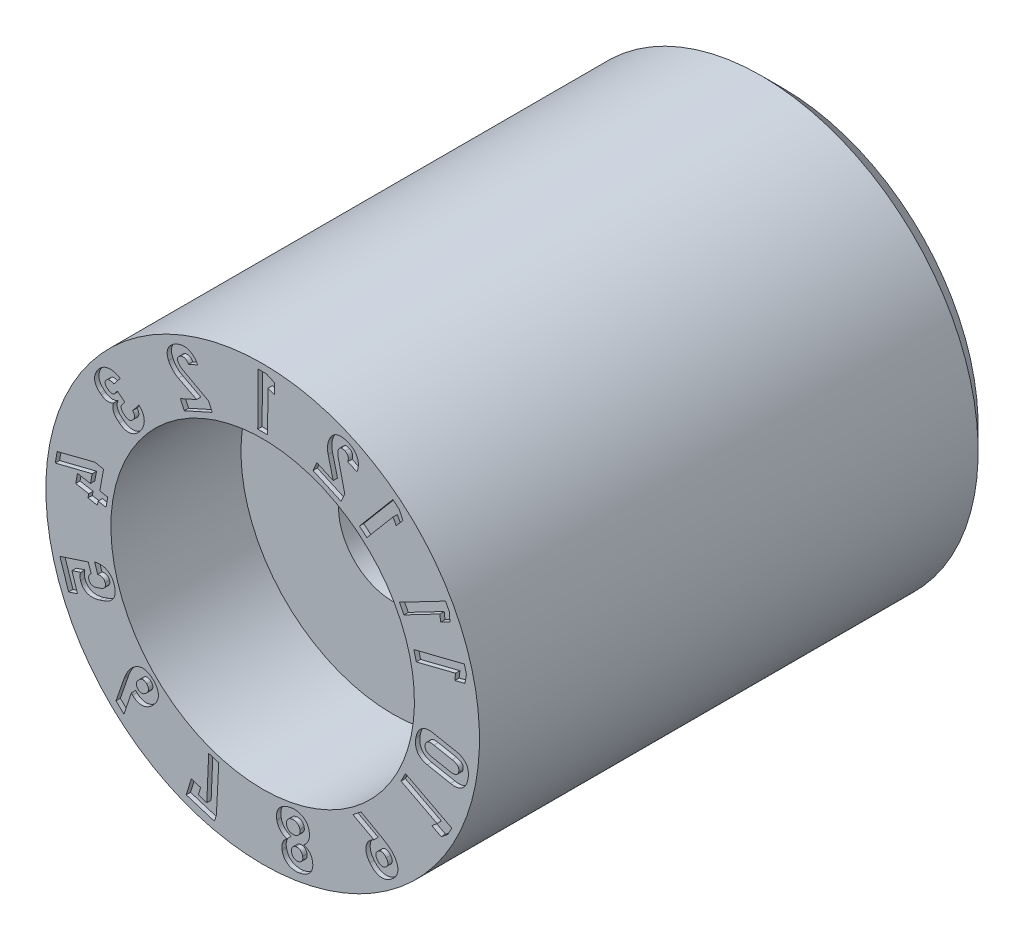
SolidWorks part; units mm, degrees
ref_plane "Front Plane" through (0, 0, 0) normal (0, 0, 1) x (1, 0, 0)
ref_plane "Top Plane" through (0, 0, 0) normal (0, 1, 0) x (1, 0, 0)
ref_plane "Right Plane" through (0, 0, 0) normal (1, 0, 0) x (0, 0, -1)
sketch "Sketch1" plane through (0, 0, 0) normal (1, 0, 0) x (0, 0, -1)
  line L0 (0, 0) -> (30.1243, 0) construction
  line L2 (12, 1.25) -> (12, 4.5)
  line L4 (11.5, 5) -> (0, 5)
  line L5 (0, 5) -> (0, 3.5)
  line L7 (0, 3.5) -> (3, 3.5)
  line L8 (3, 3.5) -> (3, 1.25)
  line L9 (3, 1.25) -> (12, 1.25)
  line L12 (12, 4.5) -> (11.5, 5)
  point P6 (12, 5)
  dimension "D1" = 12
  dimension "D2" = 10
  dimension "D3" = 7
  dimension "D4" = 3
  dimension "D5" = 2.5
revolve "Revolve1" add sketch "Sketch1" angle 360 about L0
sketch "Sketch2" plane through (0, 0, 0) normal (0, 0, 1) x (1, 0, 0)
  line L0 (-0.1135, 3.6352) -> (0.1131, 3.6331)
  line L1 (0.1131, 3.6331) -> (0.1221, 4.5702)
  line L2 (0.1221, 4.5702) -> (0.2681, 4.5131)
  line L3 (0.2681, 4.5131) -> (0.2706, 4.7542)
  line L4 (0.2706, 4.7542) -> (0.0915, 4.837)
  line L5 (0.0915, 4.837) -> (-0.102, 4.8387)
  line L6 (-0.102, 4.8387) -> (-0.1135, 3.6352)
  line L7 (-1.2464, 3.6295) -> (-1.8418, 3.9531)
  line L8 (-1.9547, 4.062) -> (-1.9554, 4.0631)
  line L9 (-1.7091, 4.1308) -> (-1.7088, 4.13)
  line L10 (-1.7088, 4.13) -> (-1.4979, 4.2247)
  line L11 (-1.4979, 4.2247) -> (-1.4982, 4.2256)
  line L12 (-2.1694, 3.9744) -> (-2.1692, 3.9735)
  line L13 (-1.9452, 3.738) -> (-1.5245, 3.5199)
  line L14 (-1.5245, 3.5199) -> (-1.8973, 3.3525)
  line L15 (-1.8973, 3.3525) -> (-1.8083, 3.1543)
  line L16 (-1.8083, 3.1543) -> (-1.1631, 3.4442)
  line L17 (-1.1631, 3.4442) -> (-1.2464, 3.6295)
  line L18 (-2.8539, 2.7446) -> (-2.998, 2.5616)
  line L19 (-3.1748, 2.37) -> (-3.1968, 2.3871)
  line L20 (-3.241, 2.5611) -> (-3.1784, 2.6408)
  line L21 (-3.1784, 2.6408) -> (-3.3492, 2.7753)
  line L22 (-3.3492, 2.7753) -> (-3.4118, 2.6956)
  line L23 (-3.5638, 2.7015) -> (-3.5802, 2.7143)
  line L24 (-3.4298, 2.8775) -> (-3.2861, 3.0602)
  line L25 (-3.7478, 2.5384) -> (-3.7195, 2.5162)
  line L26 (-3.3326, 2.1865) -> (-3.3043, 2.1642)
  line L27 (-3.8739, 1.096) -> (-4.7377, 0.8753)
  line L28 (-4.7377, 0.8753) -> (-4.7836, 0.6223)
  line L29 (-4.7836, 0.6223) -> (-3.9313, 0.8353)
  line L30 (-3.9313, 0.8353) -> (-3.9706, 0.6191)
  line L31 (-4.0281, 0.3027) -> (-3.8128, 0.2635)
  line L32 (-3.8128, 0.2635) -> (-3.7959, 0.3565)
  line L33 (-3.6685, 1.0588) -> (-3.8739, 1.096)
  line L34 (-4.2707, 0.6735) -> (-4.3112, 0.45)
  line L35 (-4.3112, 0.45) -> (-4.0112, 0.3956)
  line L36 (-3.6131, 0.3233) -> (-3.5726, 0.5469)
  line L37 (-3.5726, 0.5469) -> (-3.7554, 0.58)
  line L38 (-3.8745, -0.8977) -> (-3.8752, -0.898)
  line L39 (-3.8752, -0.898) -> (-3.8051, -1.1125)
  line L40 (-3.8051, -1.1125) -> (-3.8044, -1.1122)
  line L41 (-3.7341, -1.3553) -> (-3.8297, -1.3866)
  line L42 (-3.9556, -1.1739) -> (-4.0213, -0.9737)
  line L43 (-4.0213, -0.9737) -> (-4.6752, -1.1878)
  line L44 (-4.6752, -1.1878) -> (-4.475, -1.7986)
  line L45 (-4.475, -1.7986) -> (-4.2686, -1.731)
  line L46 (-4.2686, -1.731) -> (-4.3985, -1.3346)
  line L47 (-4.3985, -1.3346) -> (-4.1973, -1.2686)
  line L48 (-3.7595, -1.6007) -> (-3.664, -1.5694)
  line L49 (-3.0232, -2.5929) -> (-3.0237, -2.5932)
  line L50 (-3.1958, -2.8879) -> (-3.3813, -3.4249)
  line L51 (-3.3813, -3.4249) -> (-3.1992, -3.6027)
  line L52 (-3.1992, -3.6027) -> (-3.0268, -3.0886)
  line L54 (-2.5269, -3.0845) -> (-2.5265, -3.084)
  line L55 (-2.6777, -2.9168) -> (-2.6781, -2.9174)
  line L56 (-2.8555, -2.743) -> (-2.8548, -2.7424)
  line L57 (-1.0673, -4.554) -> (-1.0122, -3.4768)
  line L58 (-1.0122, -3.4768) -> (-1.245, -3.4044)
  line L59 (-1.245, -3.4044) -> (-1.288, -4.4148)
  line L60 (-1.288, -4.4148) -> (-1.4842, -4.3536)
  line L61 (-1.4842, -4.3536) -> (-1.4305, -4.1819)
  line L62 (-1.4305, -4.1819) -> (-1.6454, -4.115)
  line L63 (-1.6454, -4.115) -> (-1.7635, -4.4937)
  line L64 (-1.7635, -4.4937) -> (-1.1118, -4.6966)
  line L65 (-1.1118, -4.6966) -> (-1.0673, -4.554)
  line L66 (0.3252, -3.9393) -> (0.3287, -3.9588)
  line L67 (0.4457, -4.4703) -> (0.4513, -4.5013)
  line L68 (1.1505, -4.3755) -> (1.1449, -4.3445)
  line L69 (1.0763, -3.8242) -> (1.0728, -3.8048)
  line L70 (0.8567, -3.8773) -> (0.8587, -3.8888)
  line L71 (0.5551, -3.9426) -> (0.5528, -3.9304)
  line L72 (0.9211, -4.3757) -> (0.923, -4.387)
  line L73 (0.6684, -4.4321) -> (0.6663, -4.4198)
  line L75 (2.4713, -3.7322) -> (2.4717, -3.7328)
  line L76 (3.022, -3.298) -> (3.0214, -3.2971)
  line L77 (2.7548, -3.0924) -> (2.2697, -2.8197)
  line L78 (2.2697, -2.8197) -> (2.0814, -2.9668)
  line L79 (2.0814, -2.9668) -> (2.5645, -3.2277)
  line L80 (2.8498, -3.4447) -> (2.8504, -3.4456)
  line L81 (2.653, -3.5984) -> (2.6526, -3.5979)
  line L82 (3.2943, -1.542) -> (3.19, -1.7429)
  line L83 (3.19, -1.7429) -> (4.0203, -2.1744)
  line L84 (4.0203, -2.1744) -> (3.9037, -2.2785)
  line L85 (3.9037, -2.2785) -> (4.1173, -2.3895)
  line L86 (4.1173, -2.3895) -> (4.2717, -2.2676)
  line L87 (4.2717, -2.2676) -> (4.3609, -2.0961)
  line L88 (4.3609, -2.0961) -> (3.2943, -1.542)
  line L89 (3.7987, -1.1142) -> (4.3321, -1.2187)
  line L90 (4.4696, -0.5166) -> (3.9363, -0.4121)
  line L91 (3.9494, -0.6442) -> (4.3699, -0.7266)
  line L92 (4.3189, -0.9866) -> (3.8985, -0.9041)
  line L93 (3.4877, 1.0329) -> (3.5429, 0.8134)
  line L94 (3.5429, 0.8134) -> (4.449, 1.0412)
  line L95 (4.449, 1.0412) -> (4.4312, 0.8861)
  line L96 (4.4312, 0.8861) -> (4.664, 0.9446)
  line L97 (4.664, 0.9446) -> (4.699, 1.1381)
  line L98 (4.699, 1.1381) -> (4.6518, 1.3254)
  line L99 (4.6518, 1.3254) -> (3.4877, 1.0329)
  line L100 (3.1541, 1.8109) -> (3.2587, 1.6103)
  line L101 (3.2587, 1.6103) -> (4.0862, 2.042)
  line L102 (4.0862, 2.042) -> (4.1048, 1.8873)
  line L103 (4.1048, 1.8873) -> (4.3175, 1.9981)
  line L104 (4.3175, 1.9981) -> (4.3065, 2.1941)
  line L105 (4.3065, 2.1941) -> (4.2172, 2.3653)
  line L106 (4.2172, 2.3653) -> (3.1541, 1.8109)
  line L107 (2.2316, 2.872) -> (2.4041, 2.7264)
  line L108 (2.4041, 2.7264) -> (3.005, 3.4385)
  line L109 (3.005, 3.4385) -> (3.0807, 3.3026)
  line L110 (3.0807, 3.3026) -> (3.2351, 3.4855)
  line L111 (3.2351, 3.4855) -> (3.1508, 3.6624)
  line L112 (3.1508, 3.6624) -> (3.0036, 3.7867)
  line L113 (3.0036, 3.7867) -> (2.2316, 2.872)
  line L114 (1.8938, 3.3388) -> (1.7411, 4.0027)
  line L115 (1.7481, 4.1604) -> (1.7488, 4.1618)
  line L116 (1.9634, 4.0211) -> (1.9631, 4.0204)
  line L117 (1.9631, 4.0204) -> (2.1749, 3.9248)
  line L118 (2.1749, 3.9248) -> (2.1752, 3.9255)
  line L119 (1.539, 4.2637) -> (1.5386, 4.263)
  line L120 (1.5104, 3.9374) -> (1.6262, 3.4754)
  line L121 (1.6262, 3.4754) -> (1.2517, 3.6447)
  line L122 (1.2517, 3.6447) -> (1.1619, 3.4457)
  line L123 (1.1619, 3.4457) -> (1.8097, 3.1529)
  line L124 (1.8097, 3.1529) -> (1.8938, 3.3388)
  line L125 (-4.0112, 0.3956) -> (-4.0281, 0.3027)
  line L126 (-3.9706, 0.6191) -> (-4.2707, 0.6735)
  line L127 (-3.7959, 0.3565) -> (-3.6131, 0.3233)
  line L128 (-3.7554, 0.58) -> (-3.6685, 1.0588)
  circle A0 centre (0, 0) radius 3.645 construction
  spline S0 degree 3 poles (-1.8418, 3.9531) (-1.867, 3.9666) (-1.8968, 3.9868) (-1.9253, 4.0171) (-1.9409, 4.036) (-1.9498, 4.0515) (-1.9547, 4.062) knots 0 0 0 0 0.539913 0.664504 0.783194 1 1 1 1
  spline S1 degree 3 poles (-1.9554, 4.0631) (-1.9611, 4.0765) (-1.9676, 4.0975) (-1.9649, 4.1257) (-1.9582, 4.145) (-1.9469, 4.1629) (-1.9249, 4.1857) (-1.903, 4.1978) (-1.8875, 4.2049) knots 0 0 0 0 0.247437 0.358127 0.470367 0.587238 0.711484 1 1 1 1
  spline S2 degree 3 poles (-1.8875, 4.2049) (-1.8718, 4.2123) (-1.8468, 4.2187) (-1.813, 4.2165) (-1.7892, 4.2089) (-1.7663, 4.197) (-1.7371, 4.1724) (-1.7193, 4.1486) (-1.7091, 4.1308) knots 0 0 0 0 0.24188 0.354192 0.469267 0.588145 0.713727 1 1 1 1
  spline S3 degree 3 poles (-1.4982, 4.2256) (-1.515, 4.2564) (-1.5425, 4.3005) (-1.589, 4.3492) (-1.6253, 4.3796) (-1.6641, 4.4039) (-1.7048, 4.4224) (-1.7473, 4.4346) (-1.7914, 4.4407) (-1.8366, 4.4408) (-1.8992, 4.4322) (-1.945, 4.4167) (-1.9748, 4.4033) knots 0 0 0 0 0.185833 0.271834 0.354543 0.434819 0.51279 0.589574 0.667545 0.746873 0.827489 1 1 1 1
  spline S4 degree 3 poles (-1.9748, 4.4033) (-2.0064, 4.3891) (-2.0509, 4.3649) (-2.1024, 4.3246) (-2.1342, 4.2928) (-2.1604, 4.2589) (-2.1802, 4.2227) (-2.1942, 4.1847) (-2.2016, 4.1448) (-2.2032, 4.1035) (-2.1964, 4.0452) (-2.1818, 4.0024) (-2.1694, 3.9744) knots 0 0 0 0 0.194478 0.282548 0.366162 0.445731 0.521908 0.596846 0.672104 0.748713 0.827648 1 1 1 1
  spline S5 degree 3 poles (-2.1692, 3.9735) (-2.1577, 3.9489) (-2.1381, 3.9127) (-2.1049, 3.8689) (-2.0774, 3.8373) (-2.0473, 3.8082) (-2.0044, 3.7731) (-1.9697, 3.7505) (-1.9452, 3.738) knots 0 0 0 0 0.246354 0.371239 0.498231 0.625664 0.750716 1 1 1 1
  spline S6 degree 3 poles (-2.8278, 2.2359) (-2.8067, 2.2631) (-2.7785, 2.3056) (-2.7519, 2.3666) (-2.7382, 2.4118) (-2.7303, 2.4571) (-2.7295, 2.5021) (-2.7339, 2.5466) (-2.7452, 2.5901) (-2.7627, 2.6323) (-2.7953, 2.6873) (-2.8289, 2.723) (-2.8539, 2.7446) knots 0 0 0 0 0.181596 0.267032 0.34959 0.429882 0.508385 0.585788 0.66456 0.74419 0.825879 1 1 1 1
  spline S7 degree 3 poles (-2.998, 2.5616) (-2.9898, 2.5532) (-2.9788, 2.5398) (-2.9677, 2.5202) (-2.9613, 2.5057) (-2.9576, 2.4909) (-2.9555, 2.4762) (-2.9552, 2.4615) (-2.9571, 2.4468) (-2.961, 2.4324) (-2.9692, 2.413) (-2.9778, 2.3994) (-2.9845, 2.3908) knots 0 0 0 0 0.186026 0.272842 0.355692 0.435875 0.513332 0.590477 0.667827 0.746933 0.827427 1 1 1 1
  spline S8 degree 3 poles (-2.9845, 2.3908) (-2.9965, 2.3759) (-3.0166, 2.3556) (-3.0494, 2.3397) (-3.0741, 2.3341) (-3.0996, 2.3341) (-3.1351, 2.3433) (-3.1597, 2.3577) (-3.1748, 2.37) knots 0 0 0 0 0.26612 0.383959 0.49807 0.613267 0.731492 1 1 1 1
  spline S9 degree 3 poles (-3.1968, 2.3871) (-3.213, 2.3994) (-3.234, 2.4199) (-3.2544, 2.4511) (-3.2627, 2.474) (-3.2662, 2.4968) (-3.2624, 2.5277) (-3.2511, 2.5488) (-3.241, 2.5611) knots 0 0 0 0 0.300693 0.428097 0.545951 0.657228 0.764775 1 1 1 1
  spline S10 degree 3 poles (-3.4118, 2.6956) (-3.4197, 2.6854) (-3.4346, 2.6722) (-3.4593, 2.6646) (-3.4787, 2.6631) (-3.4993, 2.6663) (-3.5293, 2.6768) (-3.5503, 2.6905) (-3.5638, 2.7015) knots 0 0 0 0 0.227691 0.334653 0.446367 0.566263 0.695467 1 1 1 1
  spline S11 degree 3 poles (-3.5802, 2.7143) (-3.593, 2.7245) (-3.6106, 2.7409) (-3.6255, 2.7675) (-3.6316, 2.787) (-3.6333, 2.8067) (-3.6287, 2.8337) (-3.6183, 2.852) (-3.6096, 2.8631) knots 0 0 0 0 0.286987 0.411384 0.528029 0.640813 0.753409 1 1 1 1
  spline S12 degree 3 poles (-3.6096, 2.8631) (-3.6034, 2.8707) (-3.5931, 2.8814) (-3.5762, 2.8912) (-3.5629, 2.8973) (-3.5487, 2.9016) (-3.5336, 2.9037) (-3.5176, 2.904) (-3.5009, 2.9026) (-3.4836, 2.8994) (-3.4593, 2.892) (-3.4416, 2.8837) (-3.4298, 2.8775) knots 0 0 0 0 0.149186 0.222996 0.296639 0.371188 0.448158 0.528683 0.613797 0.703292 0.795969 1 1 1 1
  spline S13 degree 3 poles (-3.2861, 3.0602) (-3.3151, 3.0792) (-3.3605, 3.1028) (-3.424, 3.1231) (-3.4704, 3.1312) (-3.5162, 3.1339) (-3.5609, 3.1305) (-3.6042, 3.1209) (-3.6458, 3.1057) (-3.6853, 3.085) (-3.7352, 3.0499) (-3.7676, 3.0166) (-3.7868, 2.9921) knots 0 0 0 0 0.185755 0.272003 0.355978 0.437668 0.516842 0.5954 0.673986 0.753555 0.833229 1 1 1 1
  spline S14 degree 3 poles (-3.7868, 2.9921) (-3.8021, 2.9723) (-3.8234, 2.9424) (-3.8455, 2.9002) (-3.8584, 2.8697) (-3.8677, 2.8392) (-3.8737, 2.809) (-3.8764, 2.7789) (-3.8754, 2.7491) (-3.8715, 2.7198) (-3.8636, 2.6914) (-3.8529, 2.6636) (-3.8386, 2.6366) (-3.8209, 2.6106) (-3.7917, 2.5764) (-3.7665, 2.5528) (-3.7478, 2.5384) knots 0 0 0 0 0.144969 0.211726 0.275613 0.336511 0.395693 0.453821 0.511005 0.568118 0.624377 0.681553 0.739899 0.800707 0.863632 1 1 1 1
  spline S15 degree 3 poles (-3.7195, 2.5162) (-3.6991, 2.4997) (-3.6655, 2.4797) (-3.6168, 2.464) (-3.5799, 2.4584) (-3.5427, 2.459) (-3.4921, 2.4673) (-3.4562, 2.4831) (-3.4336, 2.4962) knots 0 0 0 0 0.256818 0.378652 0.499846 0.620687 0.742908 1 1 1 1
  spline S16 degree 3 poles (-3.4336, 2.4962) (-3.4395, 2.4833) (-3.4475, 2.4635) (-3.453, 2.4361) (-3.456, 2.4159) (-3.4559, 2.3957) (-3.4544, 2.3755) (-3.4511, 2.3551) (-3.4452, 2.335) (-3.4377, 2.3148) (-3.4283, 2.2951) (-3.4169, 2.276) (-3.4039, 2.257) (-3.3886, 2.2388) (-3.3657, 2.2142) (-3.3465, 2.1971) (-3.3326, 2.1865) knots 0 0 0 0 0.120732 0.179157 0.235905 0.292825 0.34969 0.407625 0.466994 0.527024 0.588865 0.651622 0.715562 0.782796 0.852538 1 1 1 1
  spline S17 degree 3 poles (-3.3043, 2.1642) (-3.2787, 2.1441) (-3.2386, 2.1178) (-3.181, 2.0951) (-3.139, 2.0849) (-3.0971, 2.0814) (-3.0556, 2.0842) (-3.0147, 2.0938) (-2.9746, 2.11) (-2.9356, 2.1325) (-2.8837, 2.172) (-2.8491, 2.2088) (-2.8278, 2.2359) knots 0 0 0 0 0.178576 0.260028 0.338439 0.414233 0.489378 0.565161 0.643413 0.725361 0.811053 1 1 1 1
  spline S18 degree 3 poles (-3.4252, -1.1196) (-3.4344, -1.0902) (-3.454, -1.0488) (-3.4885, -0.9994) (-3.5187, -0.9674) (-3.5526, -0.9399) (-3.5902, -0.9174) (-3.6312, -0.9) (-3.6755, -0.8881) (-3.7224, -0.8816) (-3.7896, -0.8809) (-3.8406, -0.8889) (-3.8745, -0.8977) knots 0 0 0 0 0.16531 0.244619 0.323097 0.400896 0.478636 0.557815 0.639726 0.724229 0.81171 1 1 1 1
  spline S19 degree 3 poles (-3.8044, -1.1122) (-3.7848, -1.1076) (-3.7558, -1.1048) (-3.7186, -1.1094) (-3.6945, -1.1177) (-3.6732, -1.1299) (-3.6492, -1.1527) (-3.6375, -1.1751) (-3.6323, -1.1911) knots 0 0 0 0 0.286272 0.412475 0.531826 0.646991 0.760338 1 1 1 1
  spline S20 degree 3 poles (-3.6323, -1.1911) (-3.6267, -1.208) (-3.6223, -1.2344) (-3.629, -1.2683) (-3.6398, -1.2908) (-3.6557, -1.3115) (-3.6861, -1.3361) (-3.714, -1.3488) (-3.7341, -1.3553) knots 0 0 0 0 0.245289 0.356072 0.468102 0.585274 0.710394 1 1 1 1
  spline S21 degree 3 poles (-3.8297, -1.3866) (-3.8498, -1.3924) (-3.8793, -1.4007) (-3.9177, -1.3988) (-3.9422, -1.3936) (-3.9636, -1.3833) (-3.9882, -1.3635) (-3.9996, -1.3419) (-4.0045, -1.3267) knots 0 0 0 0 0.302991 0.431512 0.549948 0.661867 0.768839 1 1 1 1
  spline S22 degree 3 poles (-4.0045, -1.3267) (-4.0093, -1.3123) (-4.0135, -1.2901) (-4.012, -1.2608) (-4.0072, -1.2402) (-3.9992, -1.2209) (-3.9836, -1.197) (-3.9677, -1.1822) (-3.9556, -1.1739) knots 0 0 0 0 0.263177 0.386092 0.507659 0.627113 0.746107 1 1 1 1
  spline S23 degree 3 poles (-4.1973, -1.2686) (-4.203, -1.2799) (-4.2084, -1.2986) (-4.2125, -1.3251) (-4.2131, -1.3471) (-4.2125, -1.3697) (-4.2089, -1.3993) (-4.2042, -1.421) (-4.1993, -1.4348) knots 0 0 0 0 0.221291 0.341875 0.473265 0.609338 0.74076 1 1 1 1
  spline S24 degree 3 poles (-4.1993, -1.4348) (-4.1901, -1.4623) (-4.1727, -1.5016) (-4.1388, -1.5461) (-4.1096, -1.5733) (-4.0772, -1.5961) (-4.0406, -1.6127) (-4.001, -1.6247) (-3.9579, -1.6302) (-3.9119, -1.6314) (-3.8446, -1.6246) (-3.7937, -1.6122) (-3.7595, -1.6007) knots 0 0 0 0 0.163394 0.239335 0.313591 0.387435 0.461667 0.538628 0.619719 0.705845 0.797242 1 1 1 1
  spline S25 degree 3 poles (-3.664, -1.5694) (-3.6297, -1.5582) (-3.5811, -1.5375) (-3.5237, -1.5002) (-3.4881, -1.4691) (-3.458, -1.4352) (-3.4343, -1.3977) (-3.4167, -1.3574) (-3.4054, -1.3141) (-3.4006, -1.2684) (-3.4024, -1.2024) (-3.4147, -1.1527) (-3.4252, -1.1196) knots 0 0 0 0 0.18692 0.272248 0.353373 0.431356 0.506633 0.582239 0.658645 0.737601 0.819506 1 1 1 1
  spline S26 degree 3 poles (-2.5217, -2.5789) (-2.546, -2.5547) (-2.5854, -2.5233) (-2.6427, -2.4922) (-2.6853, -2.4764) (-2.7285, -2.4675) (-2.7719, -2.4652) (-2.8152, -2.4698) (-2.8585, -2.4811) (-2.9012, -2.4994) (-2.9594, -2.533) (-2.9983, -2.5677) (-3.0232, -2.5929) knots 0 0 0 0 0.18041 0.263073 0.342082 0.418699 0.493848 0.569748 0.64731 0.728305 0.813162 1 1 1 1
  spline S27 degree 3 poles (-3.0237, -2.5932) (-3.0391, -2.6092) (-3.0614, -2.635) (-3.0886, -2.6723) (-3.1296, -2.7348) (-3.1574, -2.7917) (-3.1771, -2.8386) knots 0 0 0 0 0.229583 0.35032 0.475661 1 1 1 1
  spline S28 degree 3 poles (-3.1771, -2.8386) (-3.1803, -2.8468) (-3.1879, -2.8627) (-3.1926, -2.8797) (-3.1958, -2.8879) knots 0 0 0 0 0.502194 1 1 1 1
  spline S29 degree 3 poles (-3.0268, -3.0886) (-3.0185, -3.1007) (-3.0087, -3.1118) (-2.9983, -3.122) knots 0.75771 0.75771 0.75771 0.75771 1 1 1 1
  spline S30 degree 3 poles (-2.9983, -3.122) (-2.9765, -3.1436) (-2.9411, -3.1717) (-2.8886, -3.1978) (-2.8492, -3.2104) (-2.8091, -3.2166) (-2.7684, -3.2167) (-2.7275, -3.2101) (-2.6865, -3.1972) (-2.6455, -3.1784) (-2.5899, -3.1431) (-2.5511, -3.1099) (-2.5269, -3.0845) knots 0 0 0 0 0.171441 0.250313 0.326601 0.40165 0.47637 0.553004 0.632356 0.715925 0.804372 1 1 1 1
  spline S31 degree 3 poles (-2.5265, -3.084) (-2.5019, -3.0581) (-2.4677, -3.0183) (-2.4349, -2.9589) (-2.4174, -2.9154) (-2.4063, -2.8715) (-2.4024, -2.8276) (-2.4055, -2.784) (-2.4155, -2.7409) (-2.4323, -2.6984) (-2.4642, -2.6414) (-2.4971, -2.603) (-2.5217, -2.5789) knots 0 0 0 0 0.186964 0.271936 0.353496 0.431521 0.507541 0.58257 0.65934 0.73787 0.820147 1 1 1 1
  spline S32 degree 3 poles (-2.6731, -2.734) (-2.6605, -2.7466) (-2.6439, -2.7673) (-2.6328, -2.7995) (-2.6307, -2.8234) (-2.6341, -2.8475) (-2.6467, -2.8811) (-2.6646, -2.9029) (-2.6777, -2.9168) knots 0 0 0 0 0.259215 0.373657 0.486603 0.601859 0.722849 1 1 1 1
  spline S33 degree 3 poles (-2.6781, -2.9174) (-2.6934, -2.9332) (-2.7178, -2.9536) (-2.7543, -2.9709) (-2.7803, -2.9767) (-2.8058, -2.977) (-2.8396, -2.9683) (-2.8616, -2.9526) (-2.8744, -2.9399) knots 0 0 0 0 0.294939 0.42017 0.537632 0.648469 0.757896 1 1 1 1
  spline S34 degree 3 poles (-2.8744, -2.9399) (-2.8876, -2.9277) (-2.903, -2.9057) (-2.9126, -2.8721) (-2.9126, -2.8463) (-2.9069, -2.8201) (-2.8906, -2.7832) (-2.8704, -2.7588) (-2.8555, -2.743) knots 0 0 0 0 0.239818 0.350386 0.463369 0.581792 0.707462 1 1 1 1
  spline S35 degree 3 poles (-2.8548, -2.7424) (-2.8416, -2.7286) (-2.8198, -2.7111) (-2.7869, -2.6977) (-2.763, -2.6938) (-2.7392, -2.6953) (-2.7071, -2.7062) (-2.6856, -2.7211) (-2.6731, -2.734) knots 0 0 0 0 0.277583 0.397867 0.512799 0.625834 0.741295 1 1 1 1
  spline S36 degree 3 poles (0.6399, -3.5445) (0.6047, -3.5508) (0.5537, -3.5647) (0.4915, -3.5938) (0.4504, -3.6196) (0.4145, -3.6491) (0.3835, -3.6821) (0.3586, -3.7188) (0.3394, -3.7586) (0.326, -3.8009) (0.3169, -3.8616) (0.3195, -3.9083) (0.3252, -3.9393) knots 0 0 0 0 0.188911 0.277156 0.362104 0.444164 0.522419 0.600161 0.677337 0.755002 0.833683 1 1 1 1
  spline S37 degree 3 poles (0.3287, -3.9588) (0.3335, -3.988) (0.3483, -4.0302) (0.3782, -4.0819) (0.4066, -4.1173) (0.4394, -4.1489) (0.488, -4.1844) (0.5294, -4.2028) (0.5582, -4.2108) knots 0 0 0 0 0.246742 0.370594 0.497967 0.62551 0.750305 1 1 1 1
  spline S38 degree 3 poles (0.5582, -4.2108) (0.5375, -4.2257) (0.5095, -4.2521) (0.4801, -4.2938) (0.463, -4.3277) (0.4501, -4.3629) (0.4406, -4.4106) (0.4414, -4.4469) (0.4457, -4.4703) knots 0 0 0 0 0.256852 0.384064 0.512332 0.638329 0.760349 1 1 1 1
  spline S39 degree 3 poles (0.4513, -4.5013) (0.4564, -4.5305) (0.4695, -4.5727) (0.4975, -4.6234) (0.5232, -4.6566) (0.5533, -4.6855) (0.5874, -4.7098) (0.6252, -4.7292) (0.6665, -4.7437) (0.7107, -4.7531) (0.7747, -4.7583) (0.8238, -4.7538) (0.8567, -4.7479) knots 0 0 0 0 0.166942 0.245901 0.324166 0.402023 0.479537 0.558337 0.639971 0.724914 0.811973 1 1 1 1
  spline S40 degree 3 poles (0.8567, -4.7479) (0.8897, -4.742) (0.9372, -4.7289) (0.9954, -4.7018) (1.0336, -4.6776) (1.0673, -4.6497) (1.096, -4.6183) (1.1193, -4.5837) (1.1375, -4.5461) (1.1497, -4.5059) (1.1591, -4.4488) (1.1554, -4.4046) (1.1505, -4.3755) knots 0 0 0 0 0.188044 0.27556 0.360013 0.441804 0.520509 0.598148 0.675716 0.754189 0.833243 1 1 1 1
  spline S41 degree 3 poles (1.1449, -4.3445) (1.1411, -4.3205) (1.1286, -4.2859) (1.1027, -4.2442) (1.0778, -4.216) (1.0496, -4.1905) (1.0072, -4.1619) (0.9713, -4.1475) (0.9467, -4.1408) knots 0 0 0 0 0.242284 0.363838 0.489933 0.61722 0.744144 1 1 1 1
  spline S42 degree 3 poles (0.9467, -4.1408) (0.9711, -4.1228) (1.0038, -4.0909) (1.0378, -4.0406) (1.0576, -3.9995) (1.0723, -3.9565) (1.0834, -3.8979) (1.0815, -3.8532) (1.0763, -3.8242) knots 0 0 0 0 0.252403 0.376971 0.504622 0.631472 0.755007 1 1 1 1
  spline S43 degree 3 poles (1.0728, -3.8048) (1.0674, -3.7737) (1.0537, -3.7289) (1.0239, -3.6752) (0.9965, -3.6402) (0.9645, -3.6096) (0.9282, -3.5841) (0.8879, -3.5635) (0.8437, -3.5487) (0.7964, -3.5387) (0.7278, -3.5331) (0.6752, -3.5383) (0.6399, -3.5445) knots 0 0 0 0 0.166388 0.244848 0.322812 0.400145 0.477566 0.556117 0.637944 0.722947 0.810667 1 1 1 1
  spline S44 degree 3 poles (0.6786, -3.7585) (0.6928, -3.7556) (0.714, -3.7544) (0.7417, -3.7574) (0.7609, -3.7624) (0.779, -3.7695) (0.7958, -3.7788) (0.8107, -3.7908) (0.8241, -3.8045) (0.8356, -3.8201) (0.8484, -3.8439) (0.8542, -3.8636) (0.8567, -3.8773) knots 0 0 0 0 0.179905 0.264049 0.346402 0.427052 0.506675 0.584959 0.664452 0.745288 0.826806 1 1 1 1
  spline S45 degree 3 poles (0.8587, -3.8888) (0.8609, -3.9013) (0.8623, -3.9204) (0.8579, -3.9449) (0.8527, -3.9622) (0.8447, -3.9782) (0.8344, -3.9929) (0.8221, -4.0065) (0.8074, -4.0185) (0.791, -4.0292) (0.7656, -4.0406) (0.7451, -4.0466) (0.7308, -4.049) knots 0 0 0 0 0.165972 0.245198 0.32332 0.400411 0.477437 0.556484 0.638615 0.723145 0.811259 1 1 1 1
  spline S46 degree 3 poles (0.7308, -4.049) (0.7166, -4.0516) (0.6953, -4.0537) (0.6676, -4.0512) (0.6486, -4.0473) (0.6308, -4.041) (0.6145, -4.0325) (0.5996, -4.022) (0.5863, -4.0097) (0.5751, -3.9952) (0.563, -3.9734) (0.557, -3.9553) (0.5551, -3.9426) knots 0 0 0 0 0.188292 0.275652 0.359527 0.440401 0.519826 0.597589 0.676056 0.755198 0.833743 1 1 1 1
  spline S47 degree 3 poles (0.5528, -3.9304) (0.5505, -3.9168) (0.549, -3.8963) (0.5526, -3.8696) (0.5579, -3.851) (0.5655, -3.8335) (0.5756, -3.8175) (0.5881, -3.8031) (0.6025, -3.7902) (0.619, -3.7791) (0.644, -3.767) (0.6645, -3.7611) (0.6786, -3.7585) knots 0 0 0 0 0.173386 0.255215 0.335501 0.415116 0.493571 0.571726 0.652497 0.73508 0.819819 1 1 1 1
  spline S48 degree 3 poles (0.7697, -4.2645) (0.7817, -4.2627) (0.7999, -4.2609) (0.8234, -4.2643) (0.8398, -4.2689) (0.855, -4.2758) (0.8691, -4.2845) (0.8819, -4.2953) (0.8932, -4.3081) (0.9027, -4.3228) (0.9142, -4.3447) (0.9184, -4.3633) (0.9211, -4.3757) knots 0 0 0 0 0.173571 0.255366 0.335659 0.414438 0.491432 0.570109 0.650652 0.733575 0.818033 1 1 1 1
  spline S49 degree 3 poles (0.923, -4.387) (0.9251, -4.3988) (0.9265, -4.4164) (0.9238, -4.4394) (0.9194, -4.4553) (0.9131, -4.4701) (0.9048, -4.4836) (0.8947, -4.4959) (0.8826, -4.5068) (0.8686, -4.516) (0.8478, -4.5269) (0.8302, -4.5313) (0.8182, -4.5337) knots 0 0 0 0 0.176406 0.259203 0.340268 0.418727 0.496173 0.57317 0.653516 0.735044 0.819324 1 1 1 1
  spline S50 degree 3 poles (0.8182, -4.5337) (0.8062, -4.5361) (0.7882, -4.5372) (0.7647, -4.5348) (0.7484, -4.5309) (0.7332, -4.5249) (0.7195, -4.5165) (0.7068, -4.5068) (0.6957, -4.4949) (0.6863, -4.4812) (0.6753, -4.4609) (0.6709, -4.4437) (0.6684, -4.4321) knots 0 0 0 0 0.179634 0.264185 0.346048 0.425846 0.503691 0.581471 0.660754 0.742194 0.825035 1 1 1 1
  spline S51 degree 3 poles (0.6663, -4.4198) (0.6636, -4.4075) (0.6628, -4.3891) (0.6649, -4.3649) (0.6691, -4.3481) (0.6754, -4.3324) (0.6834, -4.3177) (0.6937, -4.3048) (0.7055, -4.293) (0.7193, -4.283) (0.7401, -4.2715) (0.7578, -4.2669) (0.7697, -4.2645) knots 0 0 0 0 0.179326 0.262458 0.345262 0.426075 0.504638 0.582803 0.66166 0.74233 0.825191 1 1 1 1
  spline S52 degree 3 poles (2.5645, -3.2277) (2.5634, -3.2281) (2.5548, -3.2315) (2.5302, -3.2428) (2.5089, -3.2577) (2.4947, -3.2684) knots 0.563704 0.563704 0.563704 0.563704 0.582834 0.712799 1 1 1 1
  spline S53 degree 3 poles (2.4947, -3.2684) (2.4721, -3.2861) (2.4415, -3.3161) (2.4113, -3.3634) (2.395, -3.4007) (2.3843, -3.4399) (2.3788, -3.4803) (2.3803, -3.522) (2.3868, -3.5645) (2.3994, -3.6073) (2.4243, -3.6656) (2.4509, -3.7063) (2.4713, -3.7322) knots 0 0 0 0 0.165144 0.243174 0.321092 0.398352 0.475655 0.554734 0.636925 0.722391 0.810351 1 1 1 1
  spline S54 degree 3 poles (2.4717, -3.7328) (2.4941, -3.7611) (2.5297, -3.8003) (2.5844, -3.8414) (2.6254, -3.8648) (2.6677, -3.8815) (2.7107, -3.8911) (2.7544, -3.8942) (2.7987, -3.8902) (2.8432, -3.8792) (2.9043, -3.8549) (2.9468, -3.8268) (2.9742, -3.8057) knots 0 0 0 0 0.1875 0.273117 0.354451 0.432443 0.507964 0.582802 0.659215 0.737786 0.819997 1 1 1 1
  spline S55 degree 3 poles (2.9742, -3.8057) (3.0013, -3.7847) (3.038, -3.7499) (3.076, -3.6966) (3.0971, -3.6559) (3.1114, -3.6136) (3.1188, -3.5701) (3.1197, -3.5257) (3.1136, -3.4803) (3.1007, -3.4345) (3.0734, -3.3712) (3.0447, -3.3264) (3.022, -3.298) knots 0 0 0 0 0.177958 0.259339 0.337978 0.414607 0.489764 0.565653 0.644066 0.725866 0.811613 1 1 1 1
  spline S56 degree 3 poles (3.0214, -3.2971) (3.0084, -3.2808) (2.9871, -3.2568) (2.9546, -3.2274) (2.9276, -3.205) (2.898, -3.183) (2.8549, -3.1527) (2.8205, -3.1314) (2.7968, -3.1172) knots 0 0 0 0 0.2165 0.33186 0.453504 0.580562 0.714028 1 1 1 1
  spline S57 degree 3 poles (2.7968, -3.1172) (2.79, -3.1127) (2.7761, -3.1042) (2.7619, -3.0961) (2.7548, -3.0924) knots 0 0 0 0 0.50456 1 1 1 1
  spline S58 degree 3 poles (2.6617, -3.4056) (2.6757, -3.3947) (2.6989, -3.3813) (2.7331, -3.3762) (2.758, -3.3785) (2.7826, -3.3866) (2.816, -3.4061) (2.8368, -3.4284) (2.8498, -3.4447) knots 0 0 0 0 0.246462 0.358247 0.470729 0.587689 0.71127 1 1 1 1
  spline S59 degree 3 poles (2.8504, -3.4456) (2.863, -3.4613) (2.8781, -3.4865) (2.8887, -3.5224) (2.8899, -3.5476) (2.8857, -3.5717) (2.8717, -3.6029) (2.8533, -3.6221) (2.8392, -3.633) knots 0 0 0 0 0.283688 0.407363 0.523428 0.635844 0.748505 1 1 1 1
  spline S60 degree 3 poles (2.8392, -3.633) (2.8251, -3.6443) (2.8016, -3.6575) (2.7675, -3.6638) (2.7428, -3.662) (2.7186, -3.6546) (2.6861, -3.6354) (2.6653, -3.6146) (2.653, -3.5984) knots 0 0 0 0 0.252509 0.366768 0.478577 0.594424 0.717026 1 1 1 1
  spline S61 degree 3 poles (2.6526, -3.5979) (2.6398, -3.5814) (2.6237, -3.5557) (2.6125, -3.5187) (2.6109, -3.493) (2.6146, -3.4682) (2.6288, -3.4363) (2.6474, -3.4167) (2.6617, -3.4056) knots 0 0 0 0 0.286765 0.410369 0.526244 0.638109 0.751247 1 1 1 1
  spline S62 degree 3 poles (3.5341, -0.6977) (3.5285, -0.7247) (3.5238, -0.7647) (3.5227, -0.8169) (3.5258, -0.8529) (3.532, -0.887) (3.5418, -0.9189) (3.5546, -0.9489) (3.5707, -0.9768) (3.5897, -1.0024) (3.6117, -1.0257) (3.6363, -1.0467) (3.6635, -1.0651) (3.6935, -1.081) (3.7381, -1.0995) (3.7739, -1.1094) (3.7987, -1.1142) knots 0 0 0 0 0.146914 0.214553 0.278421 0.339962 0.39889 0.456643 0.513636 0.570324 0.626863 0.684201 0.742457 0.802311 0.8653 1 1 1 1
  spline S63 degree 3 poles (4.3321, -1.2187) (4.3571, -1.2234) (4.3942, -1.2287) (4.4428, -1.2277) (4.4767, -1.2246) (4.5089, -1.2174) (4.5396, -1.2075) (4.5686, -1.194) (4.5957, -1.1772) (4.6212, -1.1577) (4.6442, -1.1346) (4.6648, -1.1085) (4.6833, -1.0794) (4.6997, -1.0472) (4.7186, -0.9987) (4.7289, -0.9599) (4.734, -0.933) knots 0 0 0 0 0.135937 0.199121 0.259193 0.317666 0.374796 0.431191 0.487946 0.544825 0.602463 0.661311 0.722243 0.786291 0.853529 1 1 1 1
  spline S64 degree 3 poles (4.734, -0.933) (4.7392, -0.906) (4.7449, -0.8661) (4.7452, -0.8139) (4.7426, -0.7779) (4.7364, -0.7439) (4.7274, -0.7119) (4.7147, -0.682) (4.6989, -0.6542) (4.6801, -0.6285) (4.6581, -0.6054) (4.6337, -0.5843) (4.6063, -0.5659) (4.576, -0.5499) (4.531, -0.5311) (4.4946, -0.5217) (4.4696, -0.5166) knots 0 0 0 0 0.146645 0.214327 0.277956 0.339221 0.397956 0.455359 0.511965 0.568234 0.624705 0.681574 0.740176 0.800385 0.86373 1 1 1 1
  spline S65 degree 3 poles (3.9363, -0.4121) (3.9113, -0.4073) (3.8742, -0.4023) (3.8255, -0.4027) (3.7915, -0.4062) (3.7593, -0.4132) (3.7287, -0.4233) (3.6999, -0.4368) (3.6725, -0.4533) (3.6472, -0.4731) (3.6241, -0.4961) (3.6036, -0.5224) (3.5846, -0.5512) (3.5689, -0.5837) (3.5492, -0.6318) (3.5393, -0.6709) (3.5341, -0.6977) knots 0 0 0 0 0.135911 0.198949 0.25958 0.318042 0.374807 0.431191 0.487609 0.544833 0.60246 0.661297 0.722333 0.786297 0.853558 1 1 1 1
  spline S66 degree 3 poles (3.7472, -0.7396) (3.7494, -0.7291) (3.7534, -0.7139) (3.7622, -0.6956) (3.7698, -0.6836) (3.7785, -0.6729) (3.7885, -0.6637) (3.7998, -0.6559) (3.8167, -0.6474) (3.841, -0.6399) (3.8873, -0.6348) (3.9241, -0.6394) (3.9494, -0.6442) knots 0 0 0 0 0.125883 0.184118 0.238837 0.292665 0.346003 0.39862 0.4536 0.568091 0.695273 1 1 1 1
  spline S67 degree 3 poles (4.3699, -0.7266) (4.3952, -0.7315) (4.4308, -0.7415) (4.4719, -0.7636) (4.4951, -0.7825) (4.5124, -0.8049) (4.5258, -0.8415) (4.5254, -0.8716) (4.5209, -0.8914) knots 0 0 0 0 0.3041 0.431644 0.547065 0.655051 0.761123 1 1 1 1
  spline S68 degree 3 poles (4.5209, -0.8914) (4.5188, -0.9019) (4.5145, -0.9169) (4.5061, -0.9353) (4.4986, -0.9472) (4.4897, -0.9577) (4.4798, -0.967) (4.4687, -0.9749) (4.4516, -0.9831) (4.4273, -0.9905) (4.381, -0.9961) (4.3442, -0.9913) (4.3189, -0.9866) knots 0 0 0 0 0.126096 0.183341 0.238152 0.292438 0.344553 0.398015 0.452421 0.567896 0.695686 1 1 1 1
  spline S69 degree 3 poles (3.8985, -0.9041) (3.8732, -0.8991) (3.8373, -0.8896) (3.7965, -0.8669) (3.7734, -0.8481) (3.7559, -0.8258) (3.7421, -0.7894) (3.7434, -0.7593) (3.7472, -0.7396) knots 0 0 0 0 0.305332 0.432249 0.547773 0.655294 0.762055 1 1 1 1
  spline S70 degree 3 poles (1.7411, 4.0027) (1.7347, 4.0308) (1.7301, 4.0666) (1.7339, 4.1084) (1.738, 4.1326) (1.7434, 4.1498) (1.7481, 4.1604) knots 0 0 0 0 0.540691 0.665423 0.782944 1 1 1 1
  spline S71 degree 3 poles (1.7488, 4.1618) (1.7545, 4.1753) (1.7667, 4.1935) (1.7894, 4.2104) (1.8083, 4.2181) (1.8293, 4.2214) (1.8611, 4.22) (1.8848, 4.2116) (1.9006, 4.2048) knots 0 0 0 0 0.24632 0.357333 0.469334 0.58552 0.711408 1 1 1 1
  spline S72 degree 3 poles (1.9006, 4.2048) (1.9163, 4.1977) (1.9379, 4.1833) (1.9588, 4.1564) (1.9691, 4.1336) (1.9751, 4.1083) (1.9763, 4.0699) (1.9699, 4.0406) (1.9634, 4.0211) knots 0 0 0 0 0.241246 0.353768 0.468421 0.587419 0.713441 1 1 1 1
  spline S73 degree 3 poles (2.1752, 3.9255) (2.1874, 3.9587) (2.2017, 4.0088) (2.2079, 4.0762) (2.2065, 4.1237) (2.1988, 4.1689) (2.1861, 4.212) (2.1667, 4.2521) (2.142, 4.2893) (2.1121, 4.3234) (2.0641, 4.3649) (2.0219, 4.389) (1.992, 4.4026) knots 0 0 0 0 0.18598 0.27193 0.354612 0.434787 0.512454 0.589851 0.667569 0.746671 0.827282 1 1 1 1
  spline S74 degree 3 poles (1.992, 4.4026) (1.9601, 4.4167) (1.9122, 4.4347) (1.8474, 4.4466) (1.8024, 4.4493) (1.7594, 4.4465) (1.719, 4.4374) (1.6811, 4.4226) (1.646, 4.4019) (1.6139, 4.3754) (1.5744, 4.3314) (1.5517, 4.2919) (1.539, 4.2637) knots 0 0 0 0 0.194791 0.283003 0.366488 0.445618 0.521984 0.596591 0.671672 0.748093 0.827638 1 1 1 1
  spline S75 degree 3 poles (1.5386, 4.263) (1.5272, 4.2382) (1.5139, 4.1993) (1.5024, 4.1453) (1.4971, 4.1035) (1.4954, 4.0613) (1.4972, 4.0055) (1.5039, 3.9643) (1.5104, 3.9374) knots 0 0 0 0 0.245645 0.370071 0.497232 0.624319 0.750625 1 1 1 1
  dimension "D1" = 7.29
extrude "Cut-Extrude1" cut sketch "Sketch2" against normal blind 0.1
